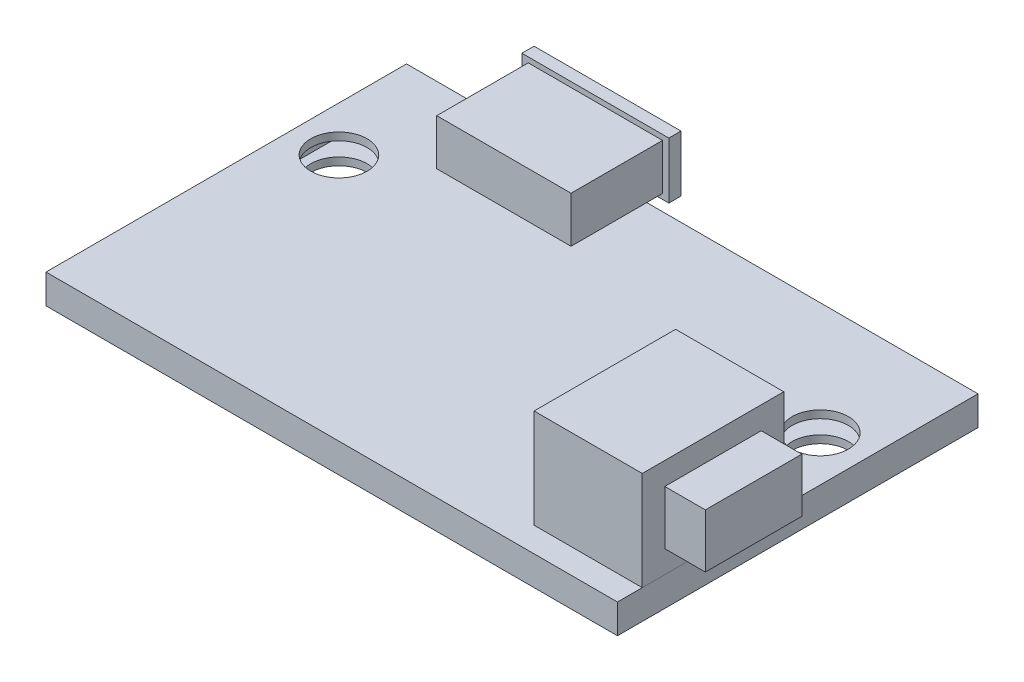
SolidWorks part; units mm, degrees
ref_plane "Front Plane" through (0, 0, 0) normal (0, 0, 1) x (1, 0, 0)
ref_plane "Top Plane" through (0, 0, 0) normal (0, 1, 0) x (1, 0, 0)
ref_plane "Right Plane" through (0, 0, 0) normal (1, 0, 0) x (0, 0, -1)
sketch "Sketch1" plane through (0, 0, 0) normal (0, 1, 0) x (1, 0, 0)
  line L1 (-16.1036, -10.16) -> (16.1036, -10.16)
  line L2 (-16.1036, -10.16) -> (-16.1036, 10.16)
  line L3 (-16.1036, 10.16) -> (16.1036, 10.16)
  line L4 (16.1036, -10.16) -> (16.1036, 10.16)
  line L5 (-16.1036, -10.16) -> (16.1036, 10.16) construction
  line L6 (-16.1036, 10.16) -> (16.1036, -10.16) construction
  point P0 (0, 0)
  dimension "D1" = 20.32
  dimension "D2" = 32.2072
extrude "Boss-Extrude1" add sketch "Sketch1" against normal blind 1.651
sketch "Sketch2" plane through (0, 0, 0) normal (0, 1, 0) x (1, 0, 0)
  line L0 (16.1036, 10.16) -> (-16.1036, 10.16) construction
  line L1 (-10.1346, 5.8928) -> (-2.5654, 5.8928)
  line L2 (-10.1346, 5.8928) -> (-10.1346, 11.049)
  line L3 (-10.1346, 11.049) -> (-2.5654, 11.049)
  line L4 (-2.5654, 5.8928) -> (-2.5654, 11.049)
  line L8 (-16.1036, 10.16) -> (-16.1036, -10.16) construction
  dimension "D1" = 5.1562
  dimension "D2" = 4.2672
  dimension "D3" = 7.5692
  dimension "D4" = 5.969
extrude "Boss-Extrude2" add sketch "Sketch2" along normal blind 2.5908
sketch "Sketch3" plane through (0, 0, -11.049) normal (0, 0, -1) x (-1, 0, 0)
  line L0 (2.5654, 2.5908) -> (10.1346, 2.5908) construction
  line L1 (2.2098, -0.2921) -> (10.4902, -0.2921)
  line L2 (2.2098, -0.2921) -> (2.2098, 2.8829)
  line L3 (2.2098, 2.8829) -> (10.4902, 2.8829)
  line L4 (10.4902, -0.2921) -> (10.4902, 2.8829)
  line L5 (2.2098, -0.2921) -> (10.4902, 2.8829) construction
  line L6 (2.2098, 2.8829) -> (10.4902, -0.2921) construction
  line L7 (10.1346, 2.5908) -> (10.1346, 0) construction
  point P0 (6.35, 1.2954)
  point P7 (6.35, 2.5908)
  point P10 (10.1346, 1.2954)
  dimension "D1" = 3.175
  dimension "D2" = 8.2804
extrude "Boss-Extrude3" add sketch "Sketch3" along normal blind 0.6858
shell "Shell1" thickness 0.4318
sketch "Sketch4" plane through (0, 0, 0) normal (0, 1, 0) x (1, 0, 0)
  line L0 (16.1036, 10.16) -> (-2.5654, 10.16) construction
  line L1 (16.1036, -10.16) -> (16.1036, 10.16) construction
  line L2 (-16.1036, 10.16) -> (-16.1036, -10.16) construction
  circle A0 centre (13.5636, 3.81) radius 1.5875
  circle A1 centre (-13.5636, 3.81) radius 1.5875
  dimension "D1" = 3.175
  dimension "D2" = 6.35
  dimension "D3" = 2.54
  dimension "D4" = 2.54
extrude "Cut-Extrude1" cut sketch "Sketch4" against normal through all
sketch "Sketch5" plane through (0, 0, 0) normal (0, 1, 0) x (1, 0, 0)
  line L0 (16.1036, -10.16) -> (16.1036, 10.16) construction
  line L1 (16.1036, -8.763) -> (10.0076, -8.763)
  line L2 (16.1036, -8.763) -> (16.1036, -0.7874)
  line L3 (16.1036, -0.7874) -> (10.0076, -0.7874)
  line L4 (10.0076, -8.763) -> (10.0076, -0.7874)
  line L5 (16.1036, -8.763) -> (10.0076, -0.7874) construction
  line L6 (16.1036, -0.7874) -> (10.0076, -8.763) construction
  line L7 (-16.1036, -10.16) -> (16.1036, -10.16) construction
  point P0 (13.0556, -4.7752)
  dimension "D1" = 7.9756
  dimension "D2" = 6.096
  dimension "D3" = 1.397
extrude "Boss-Extrude4" add sketch "Sketch5" along normal blind 5.5753 separate body
shell "Shell2" thickness 1.27
sketch "Sketch6" plane through (11.2776, 0, 0) normal (1, 0, 0) x (0, 0, -1)
  line L4 (-7.493, 1.27) -> (-2.0574, 1.27)
  line L5 (-2.0574, 1.27) -> (-2.0574, 4.3053)
  line L6 (-2.0574, 4.3053) -> (-7.493, 4.3053)
  line L7 (-7.493, 4.3053) -> (-7.493, 1.27)
  line L8 (-7.493, 1.27) -> (-2.0574, 1.27)
  line L9 (-2.0574, 1.27) -> (-2.0574, 4.3053)
  line L10 (-2.0574, 4.3053) -> (-7.493, 4.3053)
  line L11 (-7.493, 4.3053) -> (-7.493, 1.27)
  dimension "D1" = 0
extrude "Boss-Extrude5" add sketch "Sketch6" along normal blind 7.112 separate body
